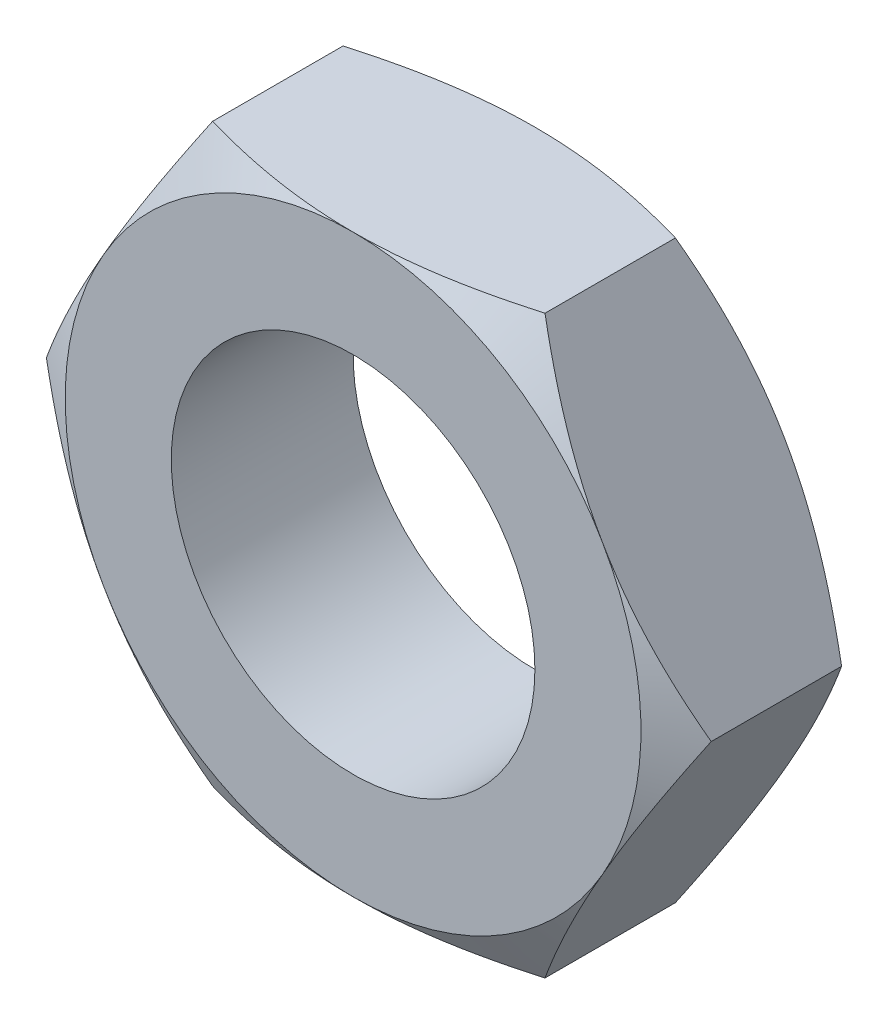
SolidWorks part; units mm, degrees
ref_plane "Front Plane" through (0, 0, 0) normal (0, 0, 1) x (1, 0, 0)
ref_plane "Top Plane" through (0, 0, 0) normal (0, 1, 0) x (1, 0, 0)
ref_plane "Right Plane" through (0, 0, 0) normal (1, 0, 0) x (0, 0, -1)
sketch "Sketch1" plane through (0, 0, 0) normal (0, 0, 1) x (1, 0, 0)
  line L1 (5.4848, 9.5) -> (-5.4848, 9.5)
  line L2 (-5.4848, 9.5) -> (-10.9697, 0)
  line L3 (-10.9697, 0) -> (-5.4848, -9.5)
  line L4 (-5.4848, -9.5) -> (5.4848, -9.5)
  line L5 (5.4848, -9.5) -> (10.9697, 0)
  line L6 (10.9697, 0) -> (5.4848, 9.5)
  circle A0 centre (0, 0) radius 9.5 construction
  circle A1 centre (0, 0) radius 6
  dimension "D2" = 12
  dimension "D1" = 19
extrude "Extrude1" add sketch "Sketch1" along normal mid plane 6
sketch "Sketch2" plane through (0, 0, 0) normal (1, 0, 0) x (0, 0, -1)
  line L0 (-3, 9.5) -> (-3, 19)
  line L1 (-3, 19) -> (2.4848, 19)
  line L2 (2.4848, 19) -> (-3, 9.5)
  dimension "D1" = 30
  dimension "D2" = 19
revolve "Cut-Revolve1" cut sketch "Sketch2" angle 360 about axis through (0, 0, 3) along (0, 0, -1)
mirror "Mirror1" about plane through (0, 0, 0) normal (0, 0, 1) of "Cut-Revolve1"
